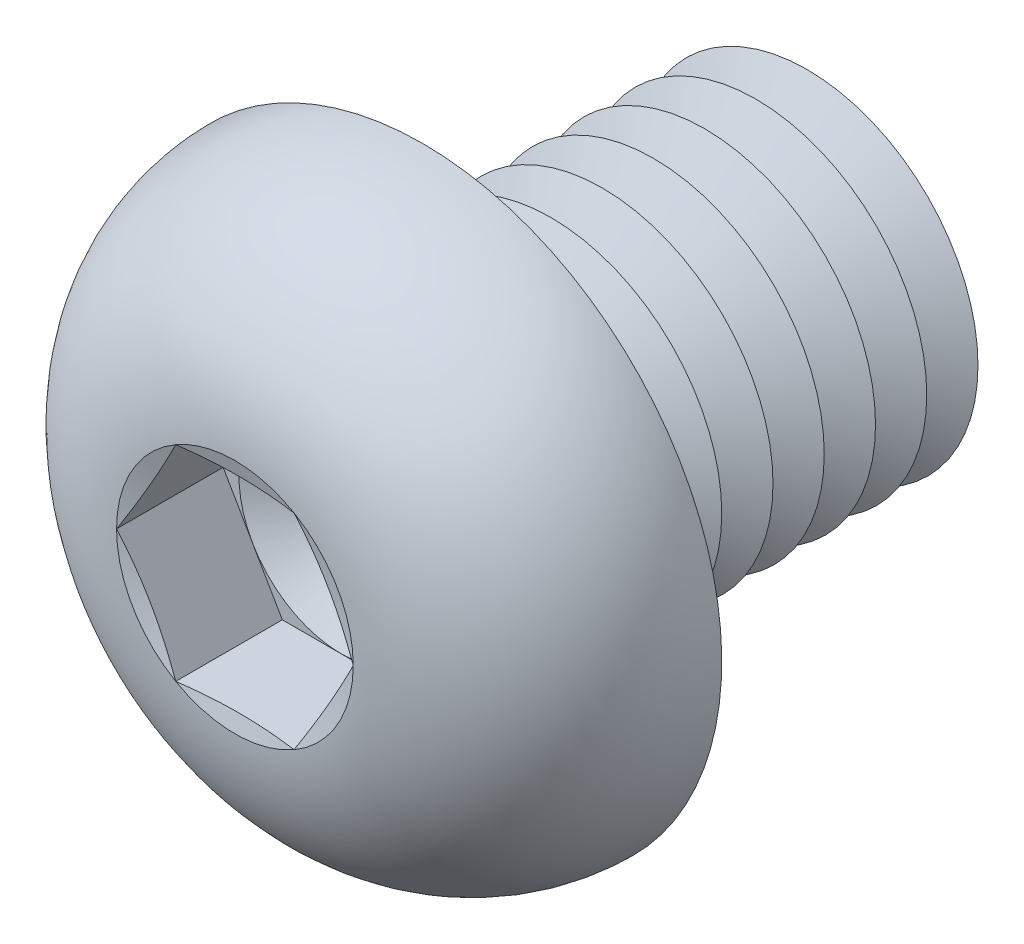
SolidWorks part; units mm, degrees
ref_plane "Front Plane" through (0, 0, 0) normal (0, 0, 1) x (1, 0, 0)
ref_plane "Top Plane" through (0, 0, 0) normal (0, 1, 0) x (1, 0, 0)
ref_plane "Right Plane" through (0, 0, 0) normal (1, 0, 0) x (0, 0, -1)
sketch "Sketch1" plane through (0, 0, 0) normal (1, 0, 0) x (0, 0, -1)
  line L0 (0, 5) -> (0, 8.75)
  line L3 (0, 5) -> (12, 5)
  line L4 (12, 5) -> (12, 0)
  line L5 (12, 0) -> (-5.5, 0) construction
  line L6 (-5.5, 0) -> (12, 0)
  line L7 (-5.5, 3.4641) -> (-5.5, 1.732) construction
  line L8 (-5.5, 1.732) -> (-5.5, 0)
  line L9 (-5.5, 3.4641) -> (-5.0359, 1.732)
  line L10 (-5.0359, 1.732) -> (-5.5, 1.732)
  line L11 (12, 0) -> (22.7481, 0) construction
  line L12 (0, 8.75) -> (-5.5, 8.75) construction
  arc A1 (0, 8.75) -> (-5.5, 3.4641) centre (0, 3.2457) ccw
  point P8 (12, 2.5)
  dimension "D1" = 17.5
  dimension "D2" = 10
  dimension "D3" = 5.5
  dimension "D4" = 6.9282
  dimension "D5" = 12
  dimension "D6" = 15
revolve "Revolve1" add sketch "Sketch1" angle 360 about L5
fillet "Fillet1" radius 0.75 1 edges at (0, 5, 0)
sketch "Sketch2" plane through (0, 0, 0) normal (1, 0, 0) x (0, 0, -1)
  line L0 (11.25, 5) -> (12.75, 5)
  line L1 (12, 5) -> (0.75, 5) construction
  line L2 (12.75, 5) -> (12, 3.701)
  line L3 (12, -5) -> (12, 5) construction
  line L4 (12, 3.701) -> (11.25, 5)
  dimension "D1" = 1.5
revolve "Cut-Revolve1" cut sketch "Sketch2" angle 360 about axis through (0, 0, -12) along (0, 0, -1)
pattern_linear "LPattern1" count 8 spacing 1.5 along (0, 0, 1) of "Cut-Revolve1"
sketch "Sketch3" plane through (0, 0, 5.5) normal (0, 0, 1) x (1, 0, 0)
  line L7 (1.7321, 3) -> (-1.7321, 3)
  line L8 (-1.7321, 3) -> (-3.4641, 0)
  line L9 (-3.4641, 0) -> (-1.7321, -3)
  line L10 (-1.7321, -3) -> (1.7321, -3)
  line L11 (1.7321, -3) -> (3.4641, 0)
  line L12 (3.4641, 0) -> (1.7321, 3)
  circle A0 centre (0, 0) radius 3 construction
  circle A3 centre (0, 0) radius 3.4641 construction
extrude "Cut-Extrude1" cut sketch "Sketch3" against normal blind 3.12
sketch "Sketch4" plane through (0, 0, 2.38) normal (0, 0, 1) x (1, 0, 0)
  line L1 (1.7321, 3) -> (-1.7321, 3) construction
  circle A0 centre (0, 0) radius 3
extrude "Cut-Extrude2" cut sketch "Sketch4" against normal through all draft 60
